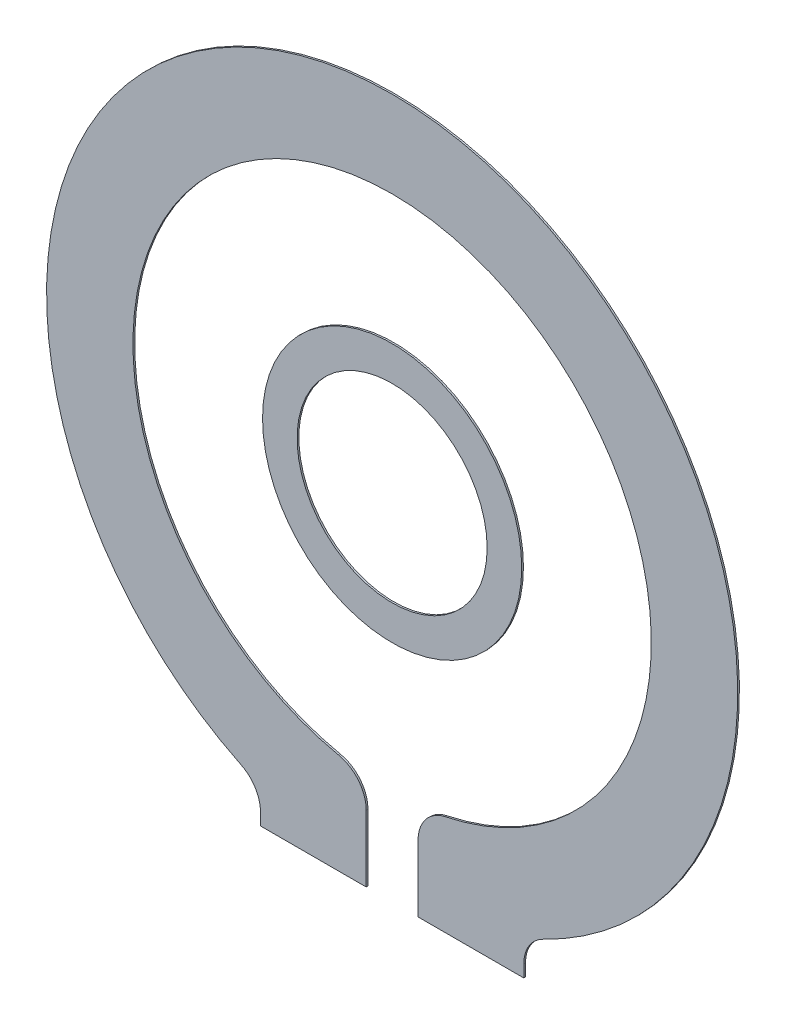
SolidWorks part; units mm, degrees
ref_plane "Front Plane" through (0, 0, 0) normal (0, 0, 1) x (1, 0, 0)
ref_plane "Top Plane" through (0, 0, 0) normal (0, 1, 0) x (1, 0, 0)
ref_plane "Right Plane" through (0, 0, 0) normal (1, 0, 0) x (0, 0, -1)
sketch "Sketch1" plane through (0, 0, 0) normal (0, 0, 1) x (1, 0, 0)
  line L680 (3.81, -10.2458) -> (0.75, -10.2458)
  line L681 (0.75, -10.2458) -> (0.75, -8.3179)
  line L682 (-0.75, -8.3179) -> (-0.75, -10.2458)
  line L683 (-0.75, -10.2458) -> (-3.81, -10.2458)
  line L684 (-3.81, -10.2458) -> (-3.81, -9.8926)
  line L685 (3.81, -9.8926) -> (3.81, -10.2458)
  circle A270 centre (0, 0) radius 2.75
  circle A271 centre (0, 0) radius 3.75
  arc A272 (1.5441, -7.3393) -> (0.75, -8.3179) centre (1.75, -8.3179) ccw
  arc A273 (1.5441, -7.3393) -> (-1.5441, -7.3393) centre (0, 0) ccw
  arc A274 (-0.75, -8.3179) -> (-1.5441, -7.3393) centre (-1.75, -8.3179) ccw
  arc A275 (-3.81, -9.8926) -> (-4.3727, -8.9933) centre (-4.81, -9.8926) ccw
  arc A276 (4.3727, -8.9933) -> (-4.3727, -8.9933) centre (0, 0) ccw
  arc A277 (4.3727, -8.9933) -> (3.81, -9.8926) centre (4.81, -9.8926) ccw
extrude "Boss-Extrude1" add sketch "Sketch1" along normal blind 0.05
